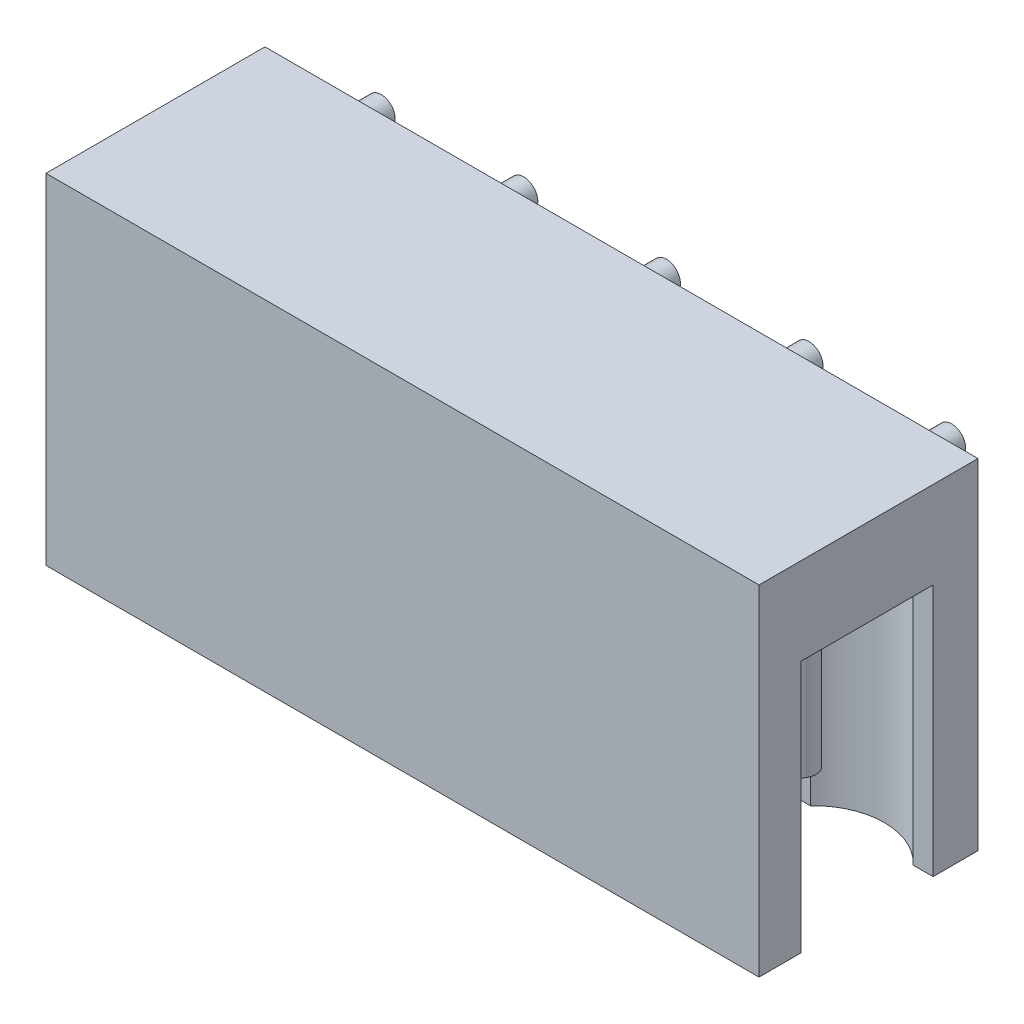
SolidWorks part; units mm, degrees
ref_plane "Plan de face" through (0, 0, 0) normal (0, 0, 1) x (1, 0, 0)
ref_plane "Plan de dessus" through (0, 0, 0) normal (0, 1, 0) x (1, 0, 0)
ref_plane "Plan de droite" through (0, 0, 0) normal (1, 0, 0) x (0, 0, -1)
sketch "Esquisse1" plane through (0, 0, 0) normal (0, 0, 1) x (1, 0, 0)
  line L1 (0, 0) -> (25.4, 0)
  line L2 (0, 0) -> (0, 12.1)
  line L3 (0, 12.1) -> (25.4, 12.1)
  line L4 (25.4, 0) -> (25.4, 12.1)
extrude "Boss.-Extru.1" add sketch "Esquisse1" along normal blind 7.8
sketch "Esquisse2" plane through (0, 0, 0) normal (0, 0, -1) x (-1, 0, 0)
  line L0 (2.1745, 10.6) -> (-17.3937, 10.6) construction
  line L1 (-2.54, 14.6177) -> (-2.54, 2.5594) construction
  line L2 (-25.4, 12.1) -> (0, 12.1) construction
  line L3 (0, 12.1) -> (0, 0) construction
  circle A0 centre (-2.54, 10.6) radius 0.5
  circle A1 centre (-7.62, 10.6) radius 0.5
  circle A2 centre (-12.7, 10.6) radius 0.5
  circle A3 centre (-17.78, 10.6) radius 0.5
  circle A4 centre (-22.86, 10.6) radius 0.5
  dimension "D3" = 5
  dimension "D1" = 1.5
  dimension "D2" = 2.54
extrude "Boss.-Extru.2" add sketch "Esquisse2" along normal blind 1.6
sketch "Esquisse3" plane through (0, 0, 0) normal (0, -1, 0) x (1, 0, 0)
  line L0 (27.3365, 3.3) -> (-2.9149, 3.3) construction
  line L1 (0, 7.8) -> (25.4, 7.8) construction
  line L2 (27.3365, 0.8) -> (-1.963, 0.8) construction
  line L3 (22.86, 0.297) -> (22.86, 9.4729) construction
  line L4 (25.4, 7.8) -> (25.4, 0) construction
  line L5 (-1.4077, 1.6) -> (25.6706, 1.6) construction
  line L6 (0, 0) -> (25.4, 0) construction
  line L7 (-2.9149, 6.3) -> (25.9086, 6.3) construction
  line L8 (24.693, 1.6) -> (25.4, 1.6)
  line L9 (25.4, 1.6) -> (25.4, 6.3)
  line L10 (25.4, 6.3) -> (0, 6.3)
  line L11 (0, 7.8) -> (0, 0) construction
  line L12 (0, 6.3) -> (0, 1.6)
  line L13 (0, 1.6) -> (0.707, 1.6)
  line L14 (4.373, 1.6) -> (5.787, 1.6)
  line L15 (9.453, 1.6) -> (10.867, 1.6)
  line L16 (14.533, 1.6) -> (15.947, 1.6)
  line L17 (19.613, 1.6) -> (21.027, 1.6)
  arc A0 (15.947, 1.6) -> (19.613, 1.6) centre (17.78, 3.3) ccw
  arc A1 (21.027, 1.6) -> (24.693, 1.6) centre (22.86, 3.3) ccw
  arc A2 (10.867, 1.6) -> (14.533, 1.6) centre (12.7, 3.3) ccw
  arc A3 (5.787, 1.6) -> (9.453, 1.6) centre (7.62, 3.3) ccw
  arc A4 (0.707, 1.6) -> (4.373, 1.6) centre (2.54, 3.3) ccw
  dimension "D4" = 1.6
  dimension "D1" = 4.5
  dimension "D2" = 2.5
  dimension "D3" = 2.54
  dimension "D5" = 1.5
  dimension "D6" = 5
extrude "Enlèv. mat.-Extru.1" cut sketch "Esquisse3" against normal blind 9
sketch "Esquisse4" plane through (0, 9, 0) normal (0, -1, 0) x (1, 0, 0)
  circle A0 centre (22.86, 3.7346) radius 0.5
  circle A1 centre (17.78, 3.7346) radius 0.5
  circle A2 centre (12.7, 3.7346) radius 0.5
  circle A3 centre (7.62, 3.7346) radius 0.5
  circle A4 centre (2.54, 3.7346) radius 0.5
  dimension "D1" = 5
extrude "Boss.-Extru.3" add sketch "Esquisse4" along normal blind 5.8
